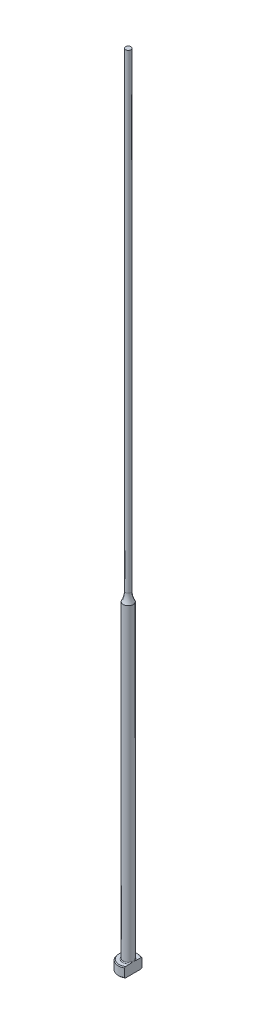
SolidWorks part; units mm, degrees
ref_plane "Front Plane" through (0, 0, 0) normal (0, 0, 1) x (1, 0, 0)
ref_plane "Top Plane" through (0, 0, 0) normal (0, 1, 0) x (1, 0, 0)
ref_plane "Right Plane" through (0, 0, 0) normal (1, 0, 0) x (0, 0, -1)
sketch "Sketch1" plane through (0, 0, 0) normal (0, 0, 1) x (1, 0, 0)
  line L0 (0, 259.9588) -> (0, -15.1925) construction
  line L1 (0, 0) -> (-3.175, 0)
  line L2 (-3.175, 0) -> (-3.175, 3.175)
  line L3 (-3.175, 3.175) -> (-1.5875, 3.175)
  line L4 (-0.8572, 104.5565) -> (-0.8572, 254)
  line L5 (-0.8572, 254) -> (0, 254)
  line L6 (0, 254) -> (0, 0)
  line L7 (-1.5875, 3.175) -> (-1.5875, 101.6)
  arc A0 (-1.5875, 101.6) -> (-0.8572, 104.5565) centre (-7.2072, 104.5565) ccw
  point P13 (-1.5875, 0)
  dimension "D1" = 6.35
  dimension "L" = 254
  dimension "D2" = 3.175
  dimension "H" = 6.35
  dimension "T" = 3.175
  dimension "D" = 1.7145
  dimension "S" = 101.6
revolve "Revolve1" add sketch "Sketch1" angle 360 about L0
chamfer "Chamfer1" distance 0.254 angle 45 2 edges at (0, 3.175, 3.175) (0, 0, 3.175)
fillet "Fillet1" radius 0.254 1 edges at (0, 3.175, 1.5875)
sketch "Sketch2" plane through (0, 0, 0) normal (0, 1, 0) x (1, 0, 0)
  line L0 (1.5875, -2.7496) -> (1.5875, 2.7496)
  circle A0 centre (0, 0) radius 3.175 construction
  arc A2 (1.5875, -2.7496) -> (1.5875, 2.7496) centre (0, 0) ccw
  circle A3 centre (0, 0) radius 3.175 construction
  circle A4 centre (0, 0) radius 1.5875 construction
extrude "Key Head" cut sketch "Sketch2" along normal up to next
